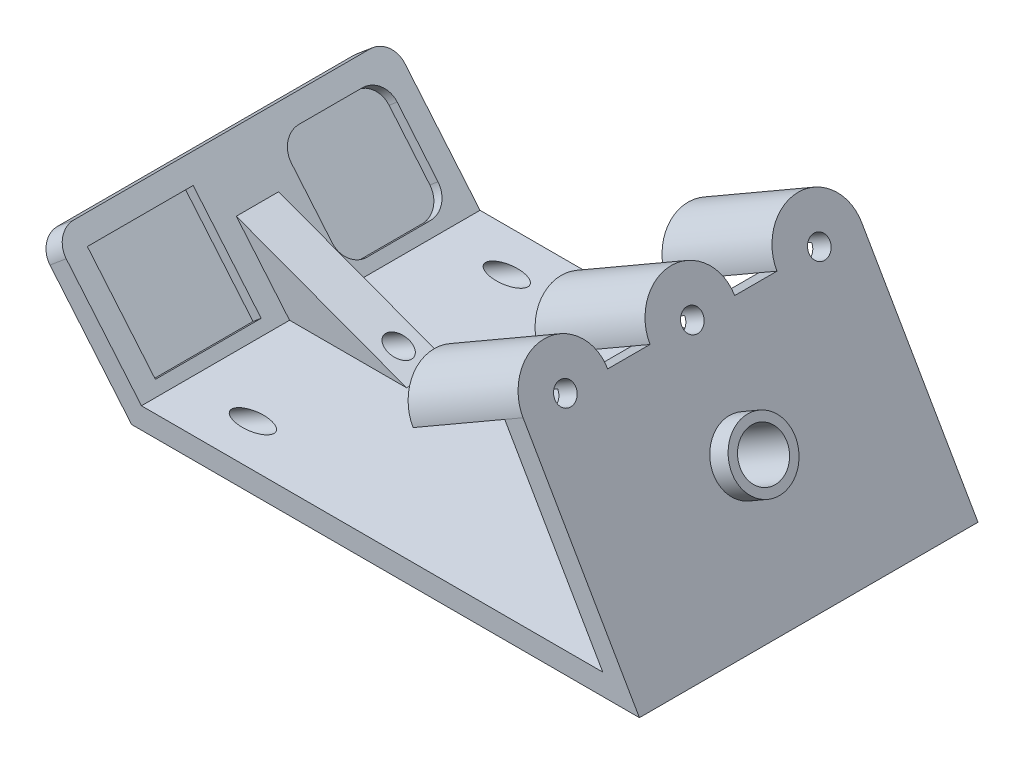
SolidWorks part; units mm, degrees
ref_plane "Front Plane" through (0, 0, 0) normal (0, 0, 1) x (1, 0, 0)
ref_plane "Top Plane" through (0, 0, 0) normal (0, 1, 0) x (1, 0, 0)
ref_plane "Right Plane" through (0, 0, 0) normal (1, 0, 0) x (0, 0, -1)
sketch "Sketch3" plane through (0, 0, 0) normal (0, 0, 1) x (1, 0, 0)
  line L0 (-22.4976, 26.8116) -> (0, 0)
  line L1 (0, 0) -> (120, 0)
  line L2 (120, 0) -> (92.5, 47.6314)
extrude "Extrude-Thin1" add sketch "Sketch3" against normal blind 80 thin
ref_plane "Plane1" through (0, 0, -40) normal (0, 0, 1) x (1, 0, 0)
sketch "Sketch4" plane through (0, 0, -40) normal (0, 0, 1) x (1, 0, 0)
  line L0 (-10.255, 20) -> (30, 5)
  line L1 (-18.6673, 30.0255) -> (2.3315, 5) construction
  line L2 (2.3315, 5) -> (111.3397, 5) construction
  dimension "D1" = 20
  dimension "D2" = 30
rib "Rib1" sketch "Sketch4" sketch "Sketch4" thickness 10 extrusion direction parallel to sketch draft on no parameters "D1"=10
sketch "Sketch5" plane through (90, 51.9615, 0) normal (0.866, 0.5, 0) x (0, 0, -1)
  line L0 (80, -5) -> (0, -5) construction
  line L1 (0, -5) -> (20, -5)
  line L2 (30, -5) -> (50, -5)
  line L3 (60, -5) -> (80, -5)
  arc A0 (30, -5) -> (50, -5) centre (40, -5) cw
  arc A1 (0, -5) -> (20, -5) centre (10, -5) cw
  arc A2 (80, -5) -> (60, -5) centre (70, -5) ccw
  dimension "D1" = 10
extrude "Boss-Extrude1" add sketch "Sketch5" against normal blind 30
sketch "Sketch6" plane through (90, 51.9615, 0) normal (0.866, 0.5, 0) x (0, 0, -1)
  line L0 (80, -60) -> (0, -60) construction
  circle A0 centre (10, -5) radius 2.5
  circle A1 centre (40, -5) radius 2.5
  circle A2 centre (70, -5) radius 2.5
  circle A3 centre (40, -30) radius 5.5
  point P13 (0, 0)
  point P14 (0, 0)
  dimension "D1" = 5
  dimension "D2" = 11
  dimension "D3" = 30
extrude "Cut-Extrude1" cut sketch "Sketch6" against normal through all
sketch "Sketch7" plane through (90, 51.9615, 0) normal (0.866, 0.5, 0) x (0, 0, -1)
  circle A0 centre (40, -30) radius 5.5 construction
  circle A1 centre (40, -30) radius 5.5
  circle A2 centre (40, -30) radius 7.5
  dimension "D1" = 15
extrude "Boss-Extrude2" add sketch "Sketch7" along normal blind 5 and the other way up to surface
sketch "Sketch8" plane through (3.8302, 3.2139, 0) normal (0.766, 0.6428, 0) x (0.6428, -0.766, 0)
  line L0 (-35, 0) -> (-2.3315, 0) construction
  line L1 (-5, 5) -> (-30, 5)
  line L2 (-5, 5) -> (-5, 30)
  line L3 (-5, 30) -> (-30, 30)
  line L4 (-30, 5) -> (-30, 30)
  line L5 (-5, 5) -> (-30, 30) construction
  line L6 (-5, 30) -> (-30, 5) construction
  line L7 (-35, 80) -> (-35, 0) construction
  line L8 (-21.9126, 40) -> (-68.7753, 40) construction
  line L9 (-21.9126, 35) -> (-21.9126, 45) construction
  line L10 (-5, 50) -> (-30, 75) construction
  line L11 (-5, 75) -> (-30, 50) construction
  line L12 (-30, 75) -> (-30, 50)
  line L13 (-5, 50) -> (-30, 50)
  line L14 (-5, 75) -> (-5, 50)
  line L15 (-5, 75) -> (-30, 75)
  point P0 (-17.5, 17.5)
  point P17 (-17.5, 62.5)
  dimension "D1" = 25
  dimension "D2" = 5
  dimension "D3" = 5
extrude "Cut-Extrude2" cut sketch "Sketch8" against normal blind 2.5
fillet "Fillet1" radius 5 6 edges at (-0.3413, 6.2407, -75) (-0.3413, 6.2407, -50) (-16.411, 25.3918, -50) (-16.411, 25.3918, -75) (-20.5825, 28.4185, -80) (-20.5825, 28.4185, 0)
equation "\"A\" = 120"
equation "\"B\"= 80"
equation "\"D2@Sketch3\"=\"A\""
equation "\"D1@Extrude-Thin1\"=\"B\""
